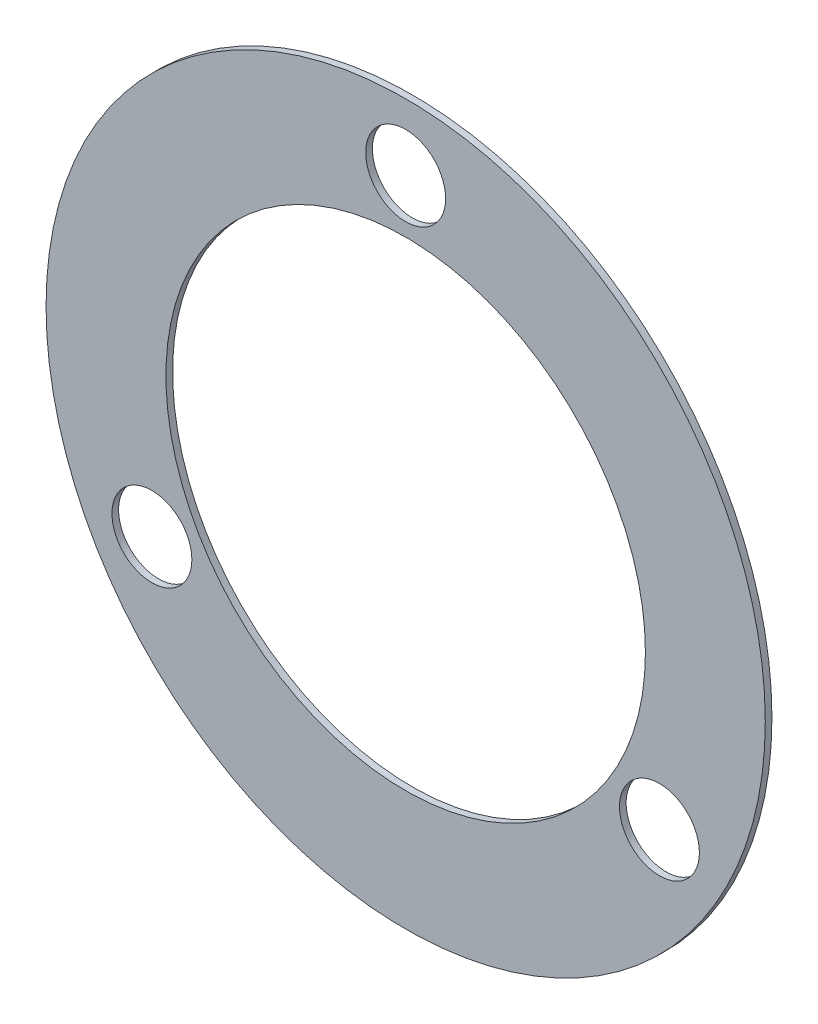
SolidWorks part; units mm, degrees
ref_plane "Plan1" through (0, 0, 0) normal (0, 0, 1) x (1, 0, 0)
ref_plane "Plan2" through (0, 0, 0) normal (0, 1, 0) x (1, 0, 0)
ref_plane "Plan3" through (0, 0, 0) normal (1, 0, 0) x (0, 0, -1)
sketch "Esquisse1" plane through (0, 0, 0) normal (0, 0, 1) x (1, 0, 0)
  line L0 (0, 34.9849) -> (0, 0) construction
  line L1 (0, 0) -> (33.1517, -19.1402) construction
  line L2 (0, 0) -> (-37.2018, -21.4785) construction
  circle A4 centre (19.0526, -11) radius 3
  circle A5 centre (-19.0526, -11) radius 3
  circle A7 centre (0, 22) radius 3
  circle A8 centre (0, 0) radius 27
  circle A11 centre (0, 0) radius 18
  dimension "D1" = 36
  dimension "D3" = 54
  dimension "D6" = 6
  dimension "D7" = 6
  dimension "D8" = 6
  dimension "D10" = 22
  dimension "D2" = 22
  dimension "D4" = 120
  dimension "D5" = 120
  dimension "D9" = 22
extrude "Base-Extrusion" add sketch "Esquisse1" along normal blind 0.5
